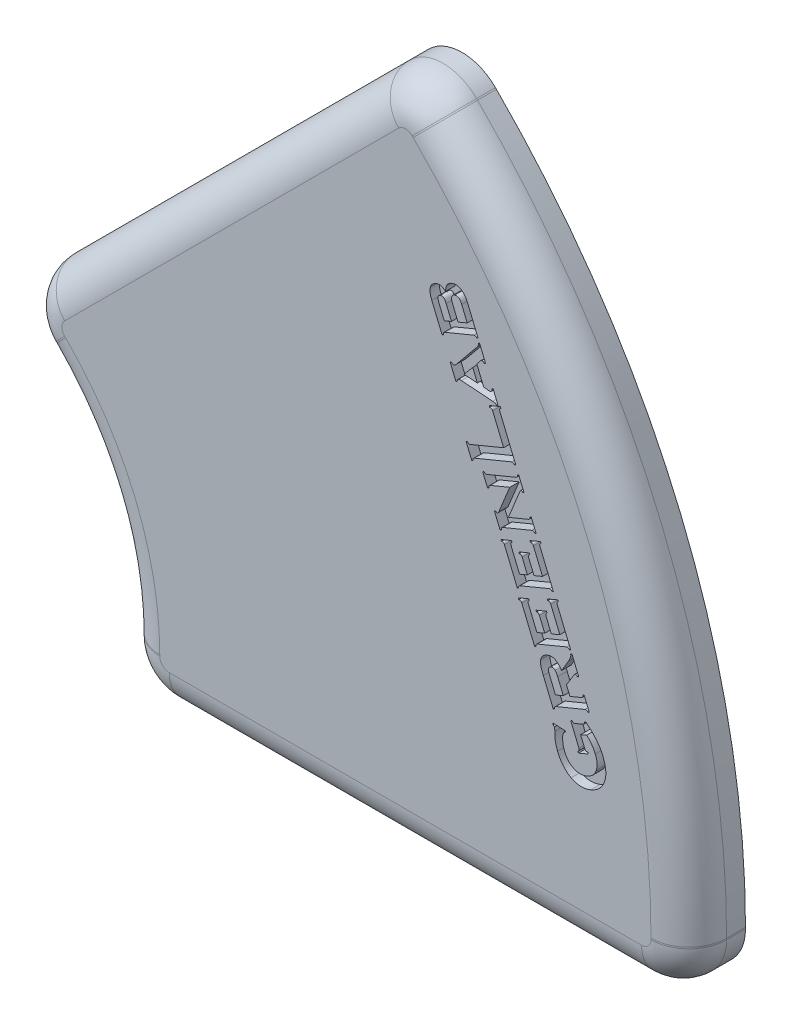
SolidWorks part; units mm, degrees
ref_plane "Front Plane" through (0, 0, 0) normal (0, 0, 1) x (1, 0, 0)
ref_plane "Top Plane" through (0, 0, 0) normal (0, 1, 0) x (1, 0, 0)
ref_plane "Right Plane" through (0, 0, 0) normal (1, 0, 0) x (0, 0, -1)
ref_plane "Plane1" through (0, 0, 3) normal (0, 0, 1) x (1, 0, 0)
sketch "Sketch1" plane through (0, 0, 3) normal (0, 0, 1) x (1, 0, 0)
  line L0 (15, -15) -> (15, 6.2127)
  line L1 (15, 6.2127) -> (0, 21.2132)
  line L2 (0, 21.2132) -> (-21.2132, 0)
  line L3 (-21.2132, 0) -> (-15, -6.2132)
  line L4 (-15, -6.2132) -> (-15, -15)
  line L5 (-15, -15) -> (15, -15)
  dimension "D1" = 15
  dimension "D2" = 30
  dimension "D3" = 36.2132
  dimension "D4" = 8.7868
  dimension "D5" = 15
  dimension "D6" = 21.2127
  dimension "D7" = 36.2132
extrude "Boss-Extrude1" add sketch "Sketch1" against normal blind 3
fillet "Fillet1" radius 2.5 4 edges at (-15, -15, 1.5) (15, -15, 1.5) (-21.2132, 0, 1.5) (0, 21.2132, 1.5)
fillet "Fillet2" radius 15 1 edges at (-15, -6.2132, 1.5)
fillet "Fillet3" radius 45 1 edges at (15, 6.2127, 1.5)
fillet "Fillet4" radius 2 12 edges at (11.5747, 4.7939, 3) (15, -12.4632, 3) (1.7941, 19.4191, 3) (14.2678, -14.2678, 3) (0, 20.1777, 3) (0, -15, 3) (-10.6066, 10.6066, 3) (-14.2678, -14.2678, 3) (-20.1777, 0, 3) (-15, -12.4632, 3) (-19.4194, -1.7938, 3) (-16.1418, -6.6862, 3)
sketch "Sketch2" plane through (0, 0, 3) normal (0, 0, 1) x (1, 0, 0)
  line L0 (12.5, -13) -> (-0.3536, 18.0312) construction
  line L1 (1.9604, 15.0581) -> (12.0338, -9.2615) construction
  line L2 (6.0732, 2.5156) -> (46200.05, 19136.6868) construction
  text T0 "GreenLab" font "Copperplate Gothic Bold" height 2.5
  point P8 (6.0732, 2.5156)
  point P9 (6.9971, 2.8983)
  dimension "D1" = 1
extrude "Cut-Extrude1" cut sketch "Sketch2" against normal blind 0.5
